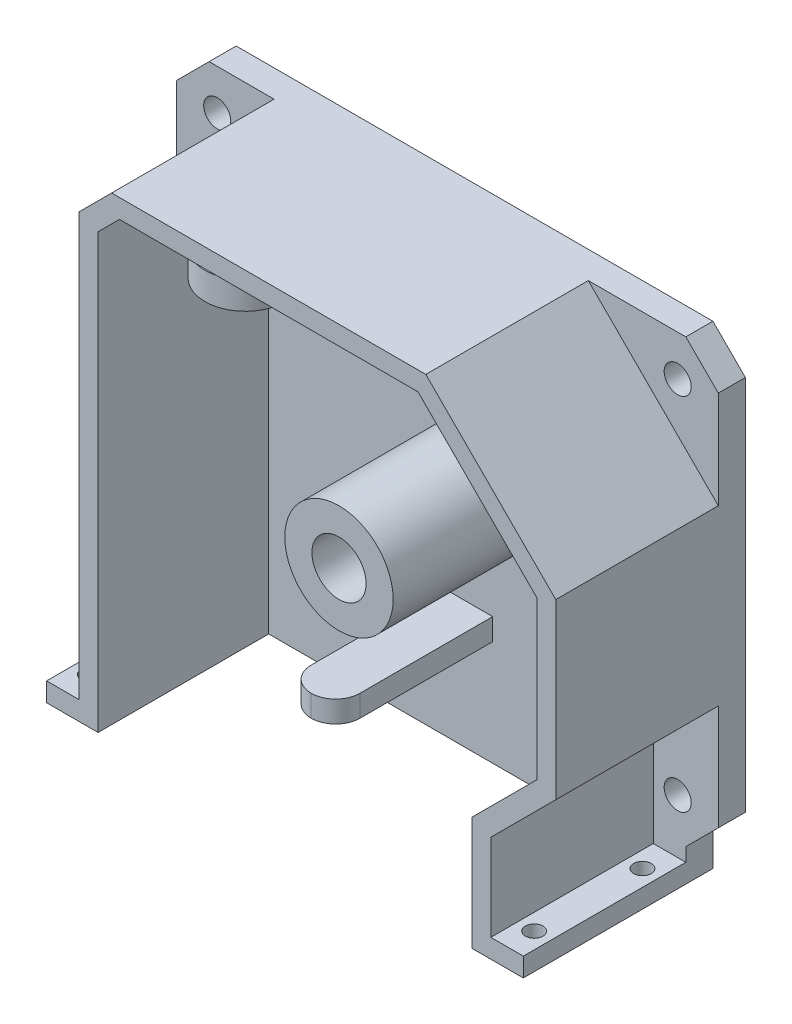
SolidWorks part; units mm, degrees
ref_plane "Face" through (0, 0, 0) normal (0, 0, 1) x (1, 0, 0)
ref_plane "Dessus" through (0, 0, 0) normal (0, 1, 0) x (1, 0, 0)
ref_plane "Droite" through (0, 0, 0) normal (1, 0, 0) x (0, 0, -1)
sketch "Esquisse1" plane through (0, 0, 0) normal (0, 0, 1) x (1, 0, 0)
  line L1 (0, 0) -> (200, 0)
  line L2 (0, 0) -> (0, 175)
  line L3 (0, 175) -> (200, 175)
  line L4 (200, 0) -> (200, 175)
  dimension "D1" = 175
  dimension "D2" = 200
extrude "Base-Extrusion" add sketch "Esquisse1" along normal blind 10
chamfer "Chanfrein1" distance 12 angle 45
sketch "Esquisse3" plane through (0, 0, 10) normal (0, 0, 1) x (1, 0, 0)
  line L0 (100, 0) -> (100, 151.4286) construction
  line L2 (0, 0) -> (200, 0) construction
  line L3 (0, 24) -> (12, 12)
  line L4 (0, 163) -> (0, 0) construction
  line L5 (12, 12) -> (12, 0)
  line L6 (0, 24) -> (0, 0)
  line L7 (0, 0) -> (12, 0)
  line L8 (200, 0) -> (188, 0)
  line L9 (188, 12) -> (188, 0)
  line L10 (200, 24) -> (188, 12)
  line L11 (200, 24) -> (200, 0)
  dimension "D1" = 45
  dimension "D2" = 12
  dimension "D3" = 24
extrude "Enlèv. mat.-Extru.1" cut sketch "Esquisse3" against normal through all
sketch "Esquisse2" plane through (0, 0, 10) normal (0, 0, 1) x (1, 0, 0)
  line L1 (152, 175) -> (36, 175)
  line L4 (200, 24) -> (200, 163) construction
  line L5 (200, 63) -> (200, 127)
  line L6 (24, 163) -> (24, 7)
  line L7 (0, 163) -> (0, 24) construction
  line L10 (12, 7) -> (24, 7)
  line L11 (188, 175) -> (12, 175) construction
  line L13 (12, 0) -> (188, 0) construction
  line L14 (12, 0) -> (12, 12) construction
  line L15 (12, 0) -> (12, 7)
  line L16 (12, 0) -> (188, 0)
  line L17 (36, 175) -> (24, 163)
  line L18 (200, 127) -> (152, 175)
  line L19 (63.7339, 95) -> (258.5593, 95) construction
  line L20 (200, 63) -> (176, 39)
  line L21 (176, 39) -> (176, 7)
  line L22 (176, 7) -> (188, 7)
  line L23 (188, 0) -> (188, 7)
  point P5 (200, 175)
  point P8 (24, 175)
  dimension "D1" = 24
  dimension "D4" = 24
  dimension "D2" = 7
  dimension "D6" = 12
  dimension "D7" = 48
  dimension "D3" = 80
extrude "Boss.-Extru.1" add sketch "Esquisse2" along normal blind 60
shell "Coque1" thickness 7
sketch "Esquisse4" plane through (0, 0, 7) normal (0, 0, 1) x (1, 0, 0)
  line L0 (-21.1111, 96) -> (232.5397, 96) construction
  line L1 (31, 0) -> (169, 0) construction
  line L3 (118.95, 163.5368) -> (118.95, 55.171) construction
  circle A0 centre (118.95, 96) radius 20
  dimension "D2" = 40
  dimension "D1" = 96
extrude "Boss.-Extru.2" add sketch "Esquisse4" along normal blind 62
sketch "Esquisse5" plane through (0, 168, 0) normal (0, -1, 0) x (1, 0, 0)
  circle A0 centre (70.95, 55.5) radius 15
  circle A1 centre (70.95, 55.5) radius 10 construction
  dimension "D1" = 30
extrude "Boss.-Extru.3" add sketch "Esquisse5" along normal blind 10
sketch "Esquisse6" plane through (0, 158, 0) normal (0, -1, 0) x (1, 0, 0)
  circle A0 centre (70.95, 55.5) radius 6
  circle A1 centre (70.95, 55.5) radius 15 construction
  dimension "D1" = 12
extrude "Enlèv. mat.-Extru.2" cut sketch "Esquisse6" against normal blind 15
sketch "Esquisse7" plane through (0, 175, 0) normal (0, 1, 0) x (-1, 0, 0)
  line L0 (-200, 70) -> (-152, 70) construction
  line L1 (-143.6106, 70) -> (-42.8312, 70)
  line L2 (-143.6106, 70) -> (-143.6106, 27.0375)
  line L3 (-143.6106, 27.0375) -> (-42.8312, 27.0375)
  line L4 (-42.8312, 70) -> (-42.8312, 27.0375)
extrude "Enlèv. mat.-Extru.3" cut sketch "Esquisse7" against normal up to next
sketch "Esquisse8" plane through (0, 0, 7) normal (0, 0, 1) x (1, 0, 0)
  line L0 (104.7, 32.2742) -> (104.7, 53.1112) construction
  line L2 (104.7, 22.9) -> (104.7, 29.9) construction
  line L3 (108.7, 38.9) -> (100.7, 38.9) construction
  line L4 (95.7, 46.9) -> (113.7, 46.9)
  line L5 (95.7, 46.9) -> (95.7, 38.9)
  line L6 (95.7, 38.9) -> (113.7, 38.9)
  line L7 (113.7, 46.9) -> (113.7, 38.9)
  line L8 (107.7, 46.9) -> (101.7, 46.9) construction
  dimension "D1" = 18
extrude "Boss.-Extru.4" add sketch "Esquisse8" along normal blind 58
fillet "Congé1" radius 9
sketch "Esquisse9" plane through (0, 0, 69) normal (0, 0, 1) x (1, 0, 0)
  circle A0 centre (118.95, 96) radius 10
  circle A1 centre (118.95, 96) radius 20 construction
  dimension "D1" = 20
extrude "Enlèv. mat.-Extru.4" cut sketch "Esquisse9" against normal blind 58
sketch "Esquisse10" plane through (0, 0, 10) normal (0, 0, 1) x (1, 0, 0)
  line L1 (36, 175) -> (12, 175) construction
  line L2 (0, 163) -> (0, 24) construction
  circle A0 centre (15, 160) radius 5
  dimension "D1" = 15
  dimension "D3" = 10
  dimension "D2" = 15
extrude "Enlèv. mat.-Extru.5" cut sketch "Esquisse10" against normal through all
pattern_linear "Répétition linéaire1" count 2 spacing 170 count 2 spacing 133
sketch "Esquisse11" plane through (0, 0, 0) normal (0, -1, 0) x (1, 0, 0)
  line L0 (100, 113.1865) -> (100, -36.3373) construction
  line L2 (31, 63.2009) -> (100, 63.2009) construction
  line L3 (31, 70) -> (31, 7) construction
  line L4 (169, 55.8416) -> (100, 55.8416) construction
  line L5 (169, 70) -> (169, 7) construction
  line L6 (18, 85.0072) -> (18, 7.7345) construction
  line L7 (12, 70) -> (31, 70) construction
  circle A0 centre (18, 60) radius 3.25
  circle A1 centre (18, 20) radius 3.25
  circle A2 centre (182, 20) radius 3.25
  circle A3 centre (182, 60) radius 3.25
  dimension "D1" = 6.5
  dimension "D2" = 40
  dimension "D3" = 10
  dimension "D4" = 82
extrude "Enlèv. mat.-Extru.6" cut sketch "Esquisse11" against normal up to next
